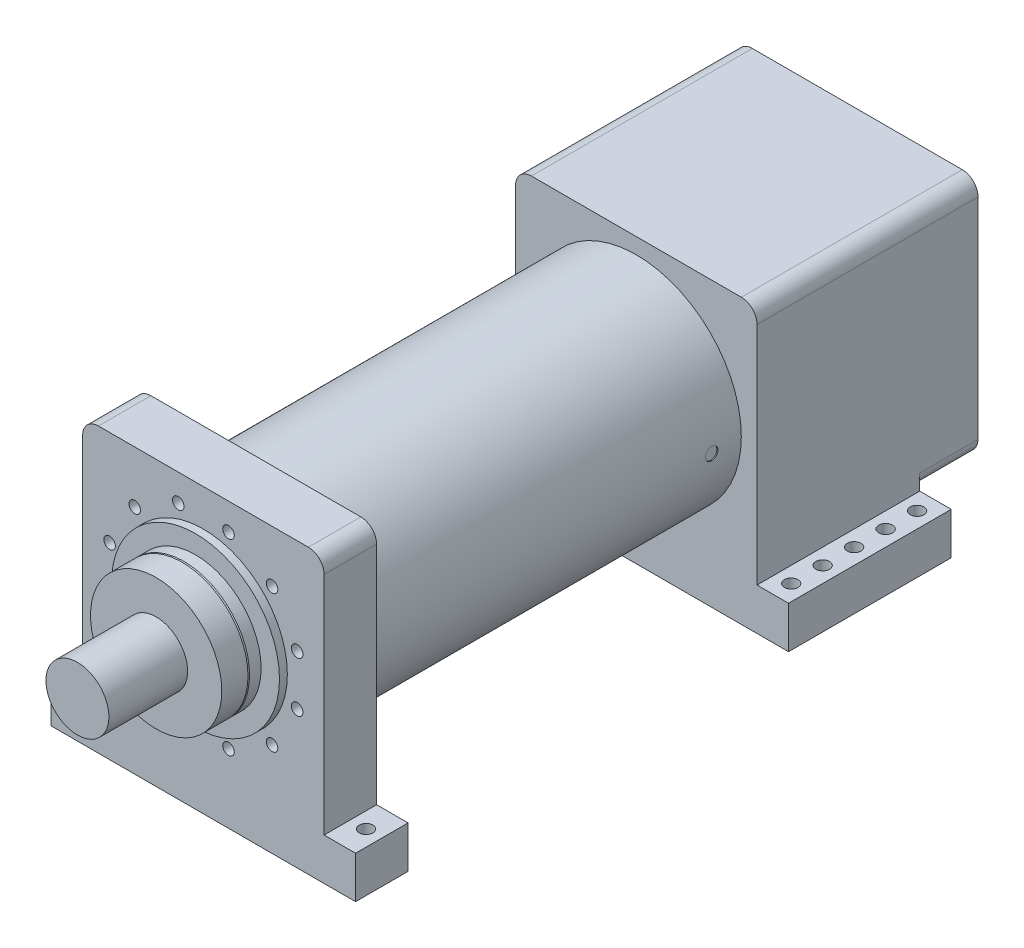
SolidWorks part; units mm, degrees
ref_plane "前视基准面" through (0, 0, 0) normal (0, 0, 1) x (1, 0, 0)
ref_plane "上视基准面" through (0, 0, 0) normal (0, 1, 0) x (1, 0, 0)
ref_plane "右视基准面" through (0, 0, 0) normal (1, 0, 0) x (0, 0, -1)
sketch "草图1" plane through (0, 0, 0) normal (0, 0, 1) x (1, 0, 0)
  circle A0 centre (0, 0) radius 200
  dimension "D1" = 400
extrude "凸台-拉伸1" add sketch "草图1" along normal blind 725
sketch "草图2" plane through (0, 0, 725) normal (0, 0, 1) x (1, 0, 0)
  line L0 (0, 0) -> (351.3656, 0) construction
  line L1 (0, 0) -> (299.4379, 80.2342) construction
  line L3 (-230, -230) -> (230, -230)
  line L4 (-230, -230) -> (-230, 230)
  line L5 (-230, 230) -> (230, 230)
  line L6 (230, -230) -> (230, 230)
  line L7 (-230, -230) -> (230, 230) construction
  line L8 (-230, 230) -> (230, -230) construction
  circle A0 centre (0, 0) radius 230 construction
  circle A1 centre (0, 0) radius 185 construction
  circle A2 centre (178.6963, 47.8815) radius 11
  circle A3 centre (178.6963, -47.8815) radius 11
  circle A4 centre (130.8148, -130.8148) radius 11
  circle A5 centre (47.8815, -178.6963) radius 11
  circle A6 centre (-47.8815, -178.6963) radius 11
  circle A7 centre (-130.8148, -130.8148) radius 11
  circle A8 centre (-178.6963, -47.8815) radius 11
  circle A9 centre (-178.6963, 47.8815) radius 11
  circle A10 centre (-130.8148, 130.8148) radius 11
  circle A11 centre (-47.8815, 178.6963) radius 11
  circle A12 centre (47.8815, 178.6963) radius 11
  circle A13 centre (130.8148, 130.8148) radius 11
  point P32 (0, 0)
  dimension "D1" = 460
  dimension "D2" = 370
  dimension "D4" = 22
  dimension "D3" = 15
  dimension "D6" = 460
  dimension "D7" = 460
  dimension "D5" = 12
extrude "凸台-拉伸2" add sketch "草图2" along normal blind 100
sketch "草图6" plane through (0, 0, 0) normal (0, 0, -1) x (-1, 0, 0)
  line L1 (-230, 230) -> (230, 230)
  line L2 (-230, 230) -> (-230, -230)
  line L3 (-230, -230) -> (230, -230)
  line L4 (230, 230) -> (230, -230)
  line L5 (-230, 230) -> (230, -230) construction
  line L6 (-230, -230) -> (230, 230) construction
  circle A0 centre (0, 0) radius 230 construction
  dimension "D1" = 460
  dimension "D2" = 460
  dimension "D3" = 460
extrude "凸台-拉伸6" add sketch "草图6" along normal blind 50
ref_plane "基准面1" through (-200, 0, 0) normal (1, 0, 0) x (0, 0, -1)
sketch "草图9" plane through (-200, 0, 0) normal (1, 0, 0) x (0, 0, -1)
  circle A0 centre (-36.5, 0) radius 12
  circle A1 centre (-670.5, 0) radius 12
  dimension "D1" = 24
  dimension "D2" = 24
  dimension "D3" = 36.5
extrude "切除-拉伸2" cut sketch "草图9" along normal blind 2
ref_plane "基准面2" through (200, 0, 0) normal (1, 0, 0) x (0, 0, -1)
sketch "草图10" plane through (200, 0, 0) normal (1, 0, 0) x (0, 0, -1)
  circle A0 centre (-56.5, 0) radius 12
  dimension "D1" = 56.5
  dimension "D2" = 24
extrude "切除-拉伸3" cut sketch "草图10" against normal blind 2
sketch "草图16" plane through (0, 0, -50) normal (0, 0, -1) x (-1, 0, 0)
  line L1 (-230, 230) -> (230, 230)
  line L2 (-230, 230) -> (-230, -230)
  line L3 (-230, -230) -> (230, -230)
  line L4 (230, 230) -> (230, -230)
  line L5 (-230, 230) -> (230, -230) construction
  line L6 (-230, -230) -> (230, 230) construction
  point P0 (0, 0)
extrude "凸台-拉伸12" add sketch "草图16" along normal blind 260 separate body
sketch "草图17" plane through (0, 0, -310) normal (0, 0, -1) x (-1, 0, 0)
  line L1 (-230, 230) -> (230, 230)
  line L2 (-230, 230) -> (-230, -230)
  line L3 (-230, -230) -> (230, -230)
  line L4 (230, 230) -> (230, -230)
  line L5 (-230, 230) -> (230, -230) construction
  line L6 (-230, -230) -> (230, 230) construction
  point P0 (0, 0)
extrude "凸台-拉伸13" add sketch "草图17" along normal blind 111 separate body
sketch "草图21" plane through (0, 0, 825) normal (0, 0, 1) x (1, 0, 0)
  circle A0 centre (0, 0) radius 160
  dimension "D1" = 320
extrude "凸台-拉伸18" add sketch "草图21" along normal blind 15
sketch "草图22" plane through (0, 0, 840) normal (0, 0, 1) x (1, 0, 0)
  circle A0 centre (0, 0) radius 125
  dimension "D1" = 250
extrude "凸台-拉伸19" add sketch "草图22" along normal blind 25
chamfer "倒角3" distance 3 angle 20 1 edges at (125, 0, 865)
sketch "草图23" plane through (0, 0, 865) normal (0, 0, 1) x (1, 0, 0)
  circle A0 centre (0, 0) radius 125
extrude "凸台-拉伸20" add sketch "草图23" along normal blind 50 separate body
sketch "草图24" plane through (0, 0, 915) normal (0, 0, 1) x (1, 0, 0)
  circle A0 centre (0, 0) radius 60
  dimension "D1" = 120
extrude "凸台-拉伸21" add sketch "草图24" along normal blind 150 separate body
sketch "草图25" plane through (0, -230, 0) normal (0, -1, 0) x (1, 0, 0)
  line L0 (230, -421) -> (230, -310) construction
  line L1 (-290, -310) -> (290, -310)
  line L2 (-290, -310) -> (-290, 0)
  line L3 (-290, 0) -> (290, 0)
  line L4 (290, -310) -> (290, 0)
  line L5 (0, 0) -> (0, -170.7449) construction
  line L6 (230, 825) -> (230, 725) construction
  line L7 (-290, 725) -> (290, 725)
  line L8 (-290, 725) -> (-290, 825)
  line L9 (-290, 825) -> (290, 825)
  line L10 (290, 725) -> (290, 825)
  circle A0 centre (-260, -275) radius 13
  circle A1 centre (-260, -215) radius 13
  circle A2 centre (-260, -155) radius 13
  circle A3 centre (-260, -95) radius 13
  circle A4 centre (-260, -35) radius 13
  circle A5 centre (-260, 775) radius 13
  circle A6 centre (260, 775) radius 13
  circle A7 centre (260, -35) radius 13
  circle A8 centre (260, -95) radius 13
  circle A9 centre (260, -155) radius 13
  circle A10 centre (260, -215) radius 13
  circle A11 centre (260, -275) radius 13
  dimension "D3" = 26
  dimension "D12" = 26
  dimension "D1" = 580
  dimension "D2" = 60
  dimension "D4" = 60
  dimension "D5" = 60
  dimension "D6" = 60
  dimension "D7" = 60
  dimension "D8" = 35
  dimension "D9" = 260
  dimension "D10" = 580
  dimension "D11" = 60
  dimension "D13" = 30
  dimension "D14" = 50
extrude "凸台-拉伸22" add sketch "草图25" along normal blind 80
fillet "圆角4" radius 30 6 edges at (230, -230, -365.5) (-230, -230, -365.5) (230, 230, 775) (-230, 230, 775) (230, 230, -210.5) (-230, 230, -210.5)
